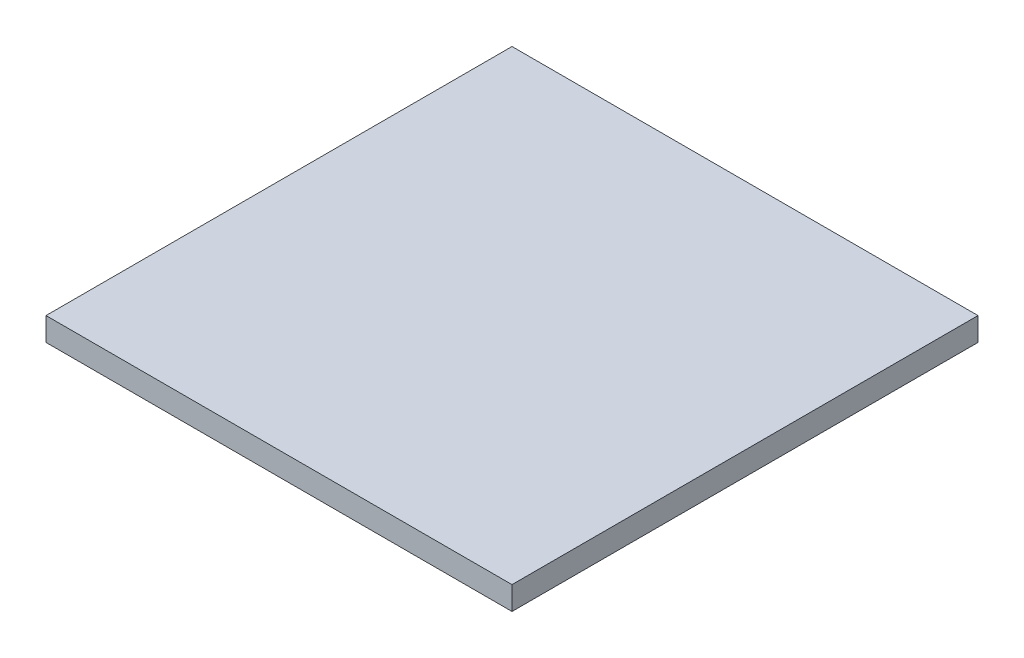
SolidWorks part; units mm, degrees
ref_plane "Plan de face" through (0, 0, 0) normal (0, 0, 1) x (1, 0, 0)
ref_plane "Plan de dessus" through (0, 0, 0) normal (0, 1, 0) x (1, 0, 0)
ref_plane "Plan de droite" through (0, 0, 0) normal (1, 0, 0) x (0, 0, -1)
sketch "Esquisse1" plane through (0, 0, 0) normal (0, 1, 0) x (1, 0, 0)
  line L1 (0, 0) -> (20, 0)
  line L2 (0, 0) -> (0, 20)
  line L3 (0, 20) -> (20, 20)
  line L4 (20, 0) -> (20, 20)
  dimension "D1" = 20
  dimension "D2" = 20
extrude "Extrusion1" add sketch "Esquisse1" along normal blind 1
